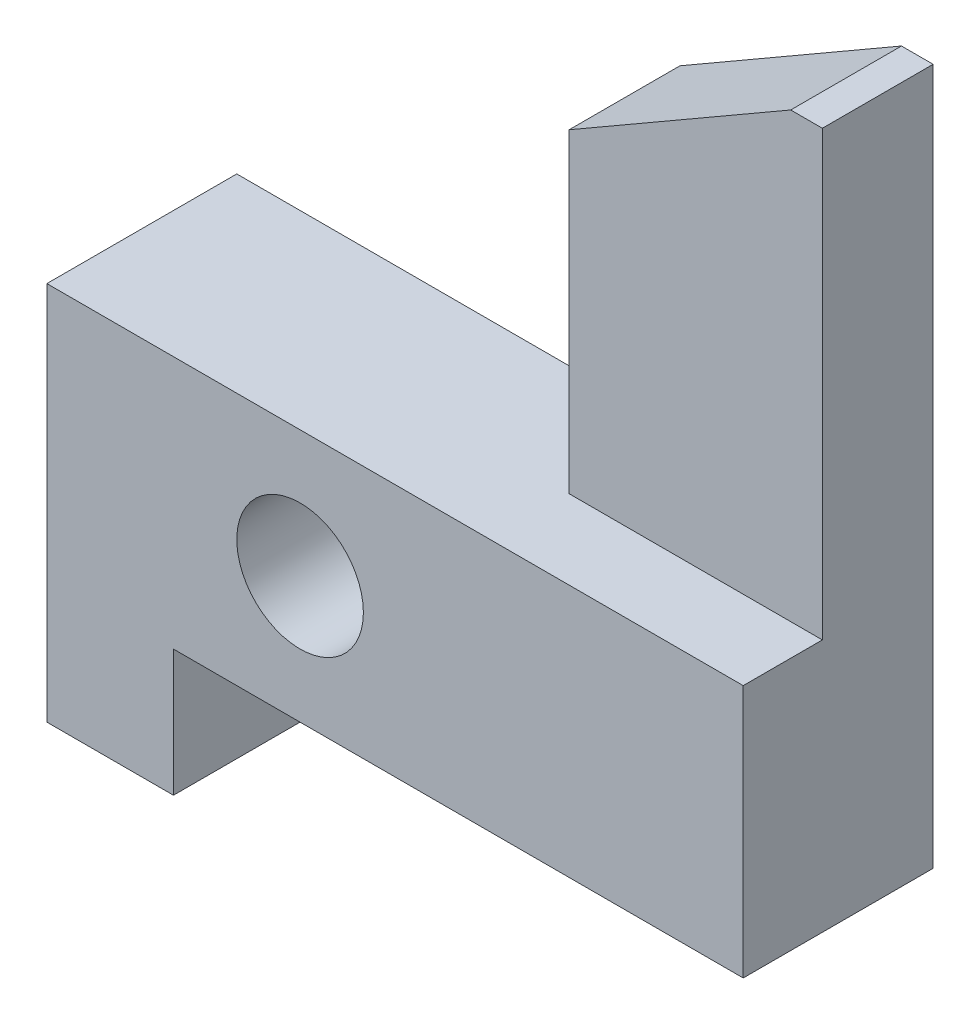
SolidWorks part; units mm, degrees
ref_plane "前视基准面" through (0, 0, 0) normal (0, 0, 1) x (1, 0, 0)
ref_plane "上视基准面" through (0, 0, 0) normal (0, 1, 0) x (1, 0, 0)
ref_plane "右视基准面" through (0, 0, 0) normal (1, 0, 0) x (0, 0, -1)
sketch "草图1" plane through (0, 0, 0) normal (0, 0, 1) x (1, 0, 0)
  line L0 (22, 4) -> (22, 26)
  line L1 (14, 12) -> (14, 21.9585)
  line L2 (0, 0) -> (0, 12)
  line L3 (21, 26) -> (22, 26)
  line L4 (14, 21.9585) -> (21, 26)
  line L5 (0, 12) -> (14, 12)
  line L6 (4, 4) -> (22, 4)
  line L7 (0, 0) -> (4, 0)
  line L8 (4, 0) -> (4, 4)
  circle A0 centre (8, 8) radius 2
extrude "凸台-拉伸1" add sketch "草图1" along normal blind 6
sketch "草图2" plane through (22, 0, 0) normal (1, 0, 0) x (0, 0, -1)
  line L0 (-3.5, 26) -> (0, 26)
  line L1 (-6, 12) -> (-3.5, 12)
  line L2 (-6, 0) -> (0, 0)
  line L3 (-3.5, 12) -> (-3.5, 26)
  line L4 (0, 0) -> (0, 26)
  line L5 (-6, 0) -> (-6, 12)
extrude "切除-拉伸1" cut sketch "草图2" against normal through all flip side to cut
sketch "草图3" plane through (0, 12, 0) normal (0, 1, 0) x (1, 0, 0)
  circle A0 centre (14, -3) radius 1.75 construction
sketch "草图4" plane through (0, 4, 0) normal (0, -1, 0) x (1, 0, 0)
  circle A0 centre (14, 3) radius 1.75
extrude "切除-拉伸2" cut sketch "草图4" against normal blind 3
